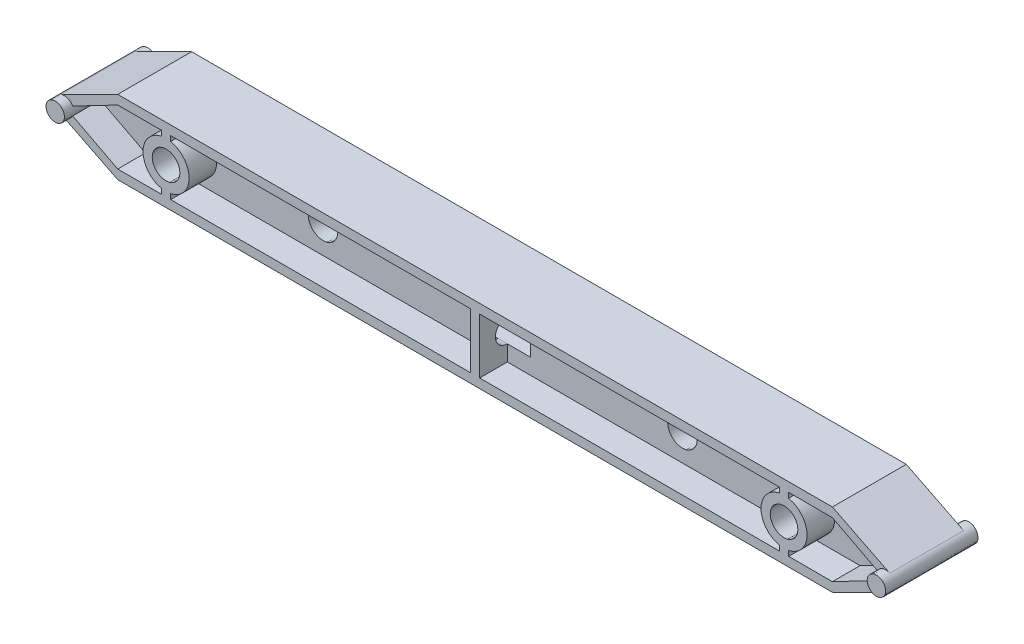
SolidWorks part; units mm, degrees
ref_plane "Front Plane" through (0, 0, 0) normal (0, 0, 1) x (1, 0, 0)
ref_plane "Top Plane" through (0, 0, 0) normal (0, 1, 0) x (1, 0, 0)
ref_plane "Right Plane" through (0, 0, 0) normal (1, 0, 0) x (0, 0, -1)
sketch "Sketch1" plane through (0, 0, 0) normal (0, 0, 1) x (1, 0, 0)
  line L0 (-74.6332, 0) -> (43.9631, 0)
  line L1 (-64.4732, -5.08) -> (-64.4732, 5.08)
  line L2 (-74.6332, 0) -> (-64.4732, 5.08)
  line L3 (-74.6332, 0) -> (-64.4732, -5.08)
  line L4 (33.8031, -5.08) -> (33.8031, 5.08)
  line L5 (33.8031, 5.08) -> (43.9631, 0)
  line L6 (33.8031, -5.08) -> (43.9631, 0)
  line L7 (-64.4732, 5.08) -> (33.8031, 5.08)
  line L8 (-64.4732, -5.08) -> (33.8031, -5.08)
  point P6 (-64.4732, 0)
  point P9 (33.8031, 0)
  dimension "D1" = 118.5963
  dimension "D2" = 90
  dimension "D3" = 10.16
  dimension "D4" = 10.16
  dimension "D5" = 90
  dimension "D6" = 10.16
  dimension "D7" = 10.16
extrude "Boss-Extrude3" add sketch "Sketch1" along normal blind 10.16 contours L2 L0 L1 | L0 L3 L1 | L7 L1 L0 L4 | L1 L8 L4 L0 | L4 L6 L0 | L5 L4 L0
sketch "Sketch4" plane through (0, 0, 10.16) normal (0, 0, 1) x (1, 0, 0)
  line L0 (-74.6332, 0) -> (-64.4732, -5.08) construction
  line L1 (-74.6332, 0) -> (-64.4732, 5.08) construction
  line L2 (33.8031, -5.08) -> (43.9631, 0) construction
  line L3 (33.8031, 5.08) -> (43.9631, 0) construction
  line L4 (33.8031, 5.08) -> (33.8031, 3.81)
  line L5 (33.8031, -5.08) -> (33.8031, -3.81)
  line L6 (33.8031, 3.81) -> (39.9968, 0.5863)
  line L7 (33.8031, -3.81) -> (39.9968, -0.5863)
  line L8 (-64.4732, 5.08) -> (-64.4732, 3.81)
  line L9 (-64.4732, -5.08) -> (-64.4732, -3.81)
  line L10 (-64.4732, 3.81) -> (-70.6668, 0.5863)
  line L11 (-64.4732, -3.81) -> (-70.6668, -0.5863)
  line L12 (-64.4732, -3.81) -> (33.8031, -3.81)
  line L13 (33.8031, 3.81) -> (-64.4732, 3.81)
  circle A0 centre (-71.7934, 0) radius 1.27
  circle A1 centre (41.1233, 0) radius 1.27
  dimension "D1" = 2.54
  dimension "D2" = 2.54
  dimension "D3" = 1.27
  dimension "D4" = 1.27
  dimension "D5" = 1.27
  dimension "D6" = 1.27
extrude "Cut-Extrude1" cut sketch "Sketch4" against normal blind 3.81 contours A1 L6 L13 L10 A0 L11 L12 L7
sketch "Sketch6" plane through (0, 0, 10.16) normal (0, 0, 1) x (1, 0, 0)
  line L0 (33.8031, -5.08) -> (43.9631, 0) construction
  line L1 (33.8031, 5.08) -> (43.9631, 0) construction
  line L2 (-74.6332, 0) -> (-64.4732, -5.08) construction
  line L3 (-74.6332, 0) -> (-64.4732, 5.08) construction
  circle A0 centre (-71.7934, 0) radius 1.27
  circle A1 centre (41.1233, 0) radius 1.27
  dimension "D1" = 2.54
  dimension "D2" = 2.54
extrude "Boss-Extrude4" add sketch "Sketch6" along normal blind 1.27
sketch "Sketch7" plane through (0, 0, 10.16) normal (0, 0, 1) x (1, 0, 0)
  line L0 (43.9631, 0) -> (41.6913, 1.1359) construction
  line L1 (41.6913, -1.1359) -> (43.9631, 0) construction
  line L2 (-72.3613, 1.1359) -> (-74.6332, 0) construction
  line L3 (-74.6332, 0) -> (-72.3613, -1.1359) construction
  line L4 (43.9631, 0) -> (41.6913, 1.1359)
  line L5 (41.6913, -1.1359) -> (43.9631, 0)
  line L6 (-72.3613, 1.1359) -> (-74.6332, 0)
  line L7 (-74.6332, 0) -> (-72.3613, -1.1359)
  arc A0 (41.6913, -1.1359) -> (41.6913, 1.1359) centre (41.1233, 0) ccw construction
  arc A1 (-72.3613, 1.1359) -> (-72.3613, -1.1359) centre (-71.7934, 0) ccw construction
  arc A2 (41.6913, -1.1359) -> (41.6913, 1.1359) centre (41.1233, 0) ccw
  arc A3 (-72.3613, 1.1359) -> (-72.3613, -1.1359) centre (-71.7934, 0) ccw
extrude "Cut-Extrude2" cut sketch "Sketch7" against normal through all
sketch "Sketch9" plane through (0, 0, 0) normal (0, 0, -1) x (-1, 0, 0)
  circle A0 centre (-41.1233, 0) radius 1.27
  circle A1 centre (71.7934, 0) radius 1.27
  arc A2 (72.3613, -1.1359) -> (72.3613, 1.1359) centre (71.7934, 0) ccw construction
  arc A3 (-41.6913, 1.1359) -> (-41.6913, -1.1359) centre (-41.1233, 0) ccw construction
  dimension "D1" = 2.54
  dimension "D2" = 2.54
extrude "Boss-Extrude5" add sketch "Sketch9" along normal blind 1.27
sketch "Sketch10" plane through (0, 0, 0) normal (0, 0, -1) x (-1, 0, 0)
  line L0 (-33.8031, 5.08) -> (-33.8031, 3.81)
  line L1 (-33.8031, -5.08) -> (-33.8031, -3.81)
  line L2 (-33.8031, 3.81) -> (-39.8533, 0)
  line L3 (-33.8031, -3.81) -> (-39.8533, 0)
  line L4 (64.4732, 5.08) -> (64.4732, 3.81)
  line L5 (64.4732, -5.08) -> (64.4732, -3.81)
  line L6 (64.4732, -3.81) -> (70.6668, -0.5863)
  line L7 (64.4732, 3.81) -> (70.6668, 0.5863)
  line L8 (64.4732, -3.81) -> (-33.8031, -3.81)
  line L9 (-33.8031, 3.81) -> (64.4732, 3.81)
  arc A0 (-41.6913, -1.1359) -> (-41.6913, 1.1359) centre (-41.1233, 0) ccw construction
  arc A1 (72.3613, 1.1359) -> (72.3613, -1.1359) centre (71.7934, 0) ccw construction
  circle A2 centre (71.7934, 0) radius 1.27 construction
  dimension "D1" = 1.27
  dimension "D2" = 1.27
  dimension "D3" = 1.27
  dimension "D4" = 1.27
extrude "Cut-Extrude3" cut sketch "Sketch10" against normal blind 3.81 contours L9 L2 L3 L8 L6 L7 M9 M5
sketch "Sketch11" plane through (0, 0, 6.35) normal (0, 0, 1) x (1, 0, 0)
  line L0 (-73.0634, 0) -> (-57.8234, 0)
  line L1 (-57.8234, 0) -> (-40.0434, 0)
  line L2 (42.3933, 0) -> (27.1533, 0)
  line L3 (27.1533, 0) -> (9.3733, 0)
  line L4 (-38.0114, 0) -> (7.3413, 0)
  line L5 (-19.145, 1.651) -> (-19.145, -1.651)
  line L6 (-19.145, 1.651) -> (-11.525, 1.651)
  line L7 (-19.145, -1.651) -> (-11.525, -1.651)
  line L8 (-11.525, 1.651) -> (-11.525, -1.651)
  line L9 (-19.145, 1.651) -> (-11.525, -1.651) construction
  line L10 (-19.145, -1.651) -> (-11.525, 1.651) construction
  circle A0 centre (-71.7934, 0) radius 1.27 construction
  circle A1 centre (-57.8234, 0) radius 1.905
  circle A2 centre (-40.0434, 0) radius 2.032
  circle A3 centre (41.1233, 0) radius 1.27 construction
  circle A4 centre (27.1533, 0) radius 1.905
  circle A5 centre (9.3733, 0) radius 2.032
  point P19 (-15.335, 0)
  point P21 (-15.335, 0)
  dimension "D2" = 3.81
  dimension "D4" = 4.064
  dimension "D7" = 3.81
  dimension "D8" = 4.064
  dimension "D1" = 15.24
  dimension "D3" = 17.78
  dimension "D5" = 15.24
  dimension "D6" = 17.78
  dimension "D9" = 7.62
  dimension "D10" = 3.302
extrude "Cut-Extrude5" cut sketch "Sketch11" against normal through all
sketch "Sketch12" plane through (0, 0, 6.35) normal (0, 0, 1) x (1, 0, 0)
  line L0 (-58.4584, 3.81) -> (-58.4584, -3.81)
  line L1 (-58.4584, 3.81) -> (-57.1884, 3.81)
  line L2 (-58.4584, -3.81) -> (-57.1884, -3.81)
  line L3 (-57.1884, 3.81) -> (-57.1884, -3.81)
  line L4 (-58.4584, 3.81) -> (-57.1884, -3.81) construction
  line L5 (-58.4584, -3.81) -> (-57.1884, 3.81) construction
  line L6 (-71.7934, 0) -> (41.1233, 0) construction
  line L9 (-15.97, 3.81) -> (-15.97, -3.81)
  line L10 (-15.97, 3.81) -> (-14.7, 3.81)
  line L11 (-15.97, -3.81) -> (-14.7, -3.81)
  line L12 (-14.7, 3.81) -> (-14.7, -3.81)
  line L13 (-15.97, 3.81) -> (-14.7, -3.81) construction
  line L14 (-15.97, -3.81) -> (-14.7, 3.81) construction
  line L15 (26.5183, 3.81) -> (26.5183, -3.81)
  line L16 (26.5183, 3.81) -> (27.7883, 3.81)
  line L17 (26.5183, -3.81) -> (27.7883, -3.81)
  line L18 (27.7883, 3.81) -> (27.7883, -3.81)
  line L19 (26.5183, 3.81) -> (27.7883, -3.81) construction
  line L20 (26.5183, -3.81) -> (27.7883, 3.81) construction
  circle A0 centre (-57.8234, 0) radius 3.175
  circle A1 centre (-57.8234, 0) radius 1.905 construction
  circle A2 centre (27.1533, 0) radius 3.175
  circle A3 centre (27.1533, 0) radius 1.905 construction
  point P12 (-15.335, 0)
  point P16 (-15.335, 0)
  dimension "D1" = 1.27
  dimension "D4" = 1.27
  dimension "D2" = 1.27
  dimension "D3" = 1.27
  dimension "D5" = 1.27
extrude "Boss-Extrude6" add sketch "Sketch12" along normal blind 3.81
sketch "Sketch13" plane through (-15.97, 0, 0) normal (-1, 0, 0) x (0, 0, 1)
  line L0 (6.35, 1.651) -> (6.35, -1.651) construction
  circle A0 centre (6.35, 0) radius 1.651
extrude "Cut-Extrude6" cut sketch "Sketch13" against normal blind 3.81
sketch "Sketch14" plane through (0, 0, 3.81) normal (0, 0, -1) x (-1, 0, 0)
  line L0 (-27.7883, 3.81) -> (-27.7883, -3.81)
  line L1 (-27.7883, 3.81) -> (-26.5183, 3.81)
  line L2 (-27.7883, -3.81) -> (-26.5183, -3.81)
  line L3 (-26.5183, 3.81) -> (-26.5183, -3.81)
  line L4 (-27.7883, 3.81) -> (-26.5183, -3.81) construction
  line L5 (-27.7883, -3.81) -> (-26.5183, 3.81) construction
  line L6 (57.1884, 3.81) -> (57.1884, -3.81)
  line L7 (57.1884, 3.81) -> (58.4584, 3.81)
  line L8 (57.1884, -3.81) -> (58.4584, -3.81)
  line L9 (58.4584, 3.81) -> (58.4584, -3.81)
  line L10 (57.1884, 3.81) -> (58.4584, -3.81) construction
  line L11 (57.1884, -3.81) -> (58.4584, 3.81) construction
  circle A0 centre (-27.1533, 0) radius 3.175
  circle A1 centre (-27.1533, 0) radius 1.905 construction
  circle A2 centre (57.8234, 0) radius 3.175
  circle A3 centre (57.8234, 0) radius 1.905 construction
  dimension "D1" = 1.27
  dimension "D3" = 1.27
  dimension "D2" = 1.27
  dimension "D4" = 1.27
extrude "Boss-Extrude7" add sketch "Sketch14" along normal blind 3.81 contours A2 L9 L6 M7 | L9 A2 L6 M6 | L6 A2 M6 | L9 A2 M6 | L6 A2 L9 M6 | A2 L6 L9 M11 | A0 L3 L0 M7 | L3 A0 L0 M3 | L0 A0 M3 | L0 A0 L3 M3 | A0 L0 L3 M11 | L3 A0 M3
